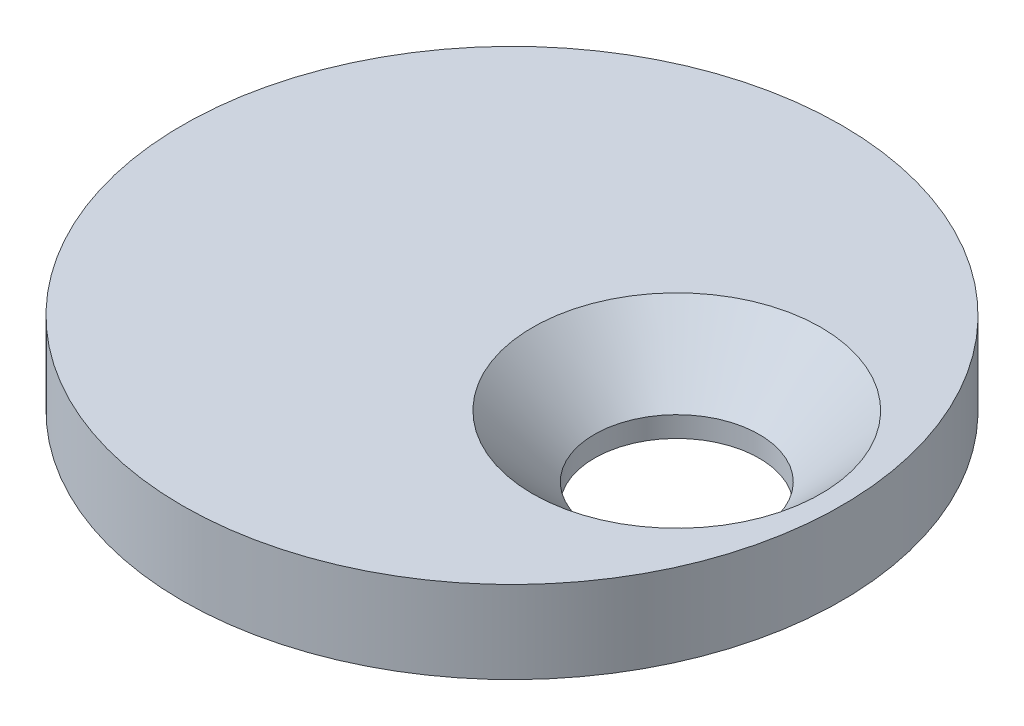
SolidWorks part; units mm, degrees
ref_plane "Front Plane" through (0, 0, 0) normal (0, 0, 1) x (1, 0, 0)
ref_plane "Top Plane" through (0, 0, 0) normal (0, 1, 0) x (1, 0, 0)
ref_plane "Right Plane" through (0, 0, 0) normal (1, 0, 0) x (0, 0, -1)
sketch "Sketch1" plane through (0, 0, 0) normal (0, 1, 0) x (1, 0, 0)
  circle A0 centre (0, 0) radius 12
  dimension "D1" = 24
extrude "Extrude1" add sketch "Sketch1" along normal blind 3
sketch "Sketch2" plane through (0, 3, 0) normal (0, 1, 0) x (1, 0, 0)
  line L0 (0, 0) -> (12, 0) construction
  circle A0 centre (0, 0) radius 12 construction
  point P6 (6, 0)
  dimension "D1" = 6
hole_wizard "CSK for M6 Countersunk Flat Head Screw1" positions "3DSketch1" profile "Sketch3" countersink size "M6" standard "ISO"
sketch3d "3DSketch1"
  point P0 (6, 3, 0)
sketch "Sketch3" plane through (6, 3, 0) normal (1, 0, 0) x (0, 0, 1)
  line L0 (0, 0) -> (0, 3)
  line L1 (0, 3) -> (3, 3)
  line L2 (3, 3) -> (3, 2.25)
  line L3 (3, 2.25) -> (5.25, 0)
  line L5 (5.25, 0) -> (0, 0)
  line L6 (-3, 2.25) -> (-5.25, 0) construction
  line L11 (0, -6.35) -> (0, 107.95) construction
  dimension "Thru Hole Dia." = 6
  dimension "Thru Hole Depth" = 3
  dimension "Near C'Sink Dia." = 10.5
  dimension "Near C'Sink Angle" = 90
